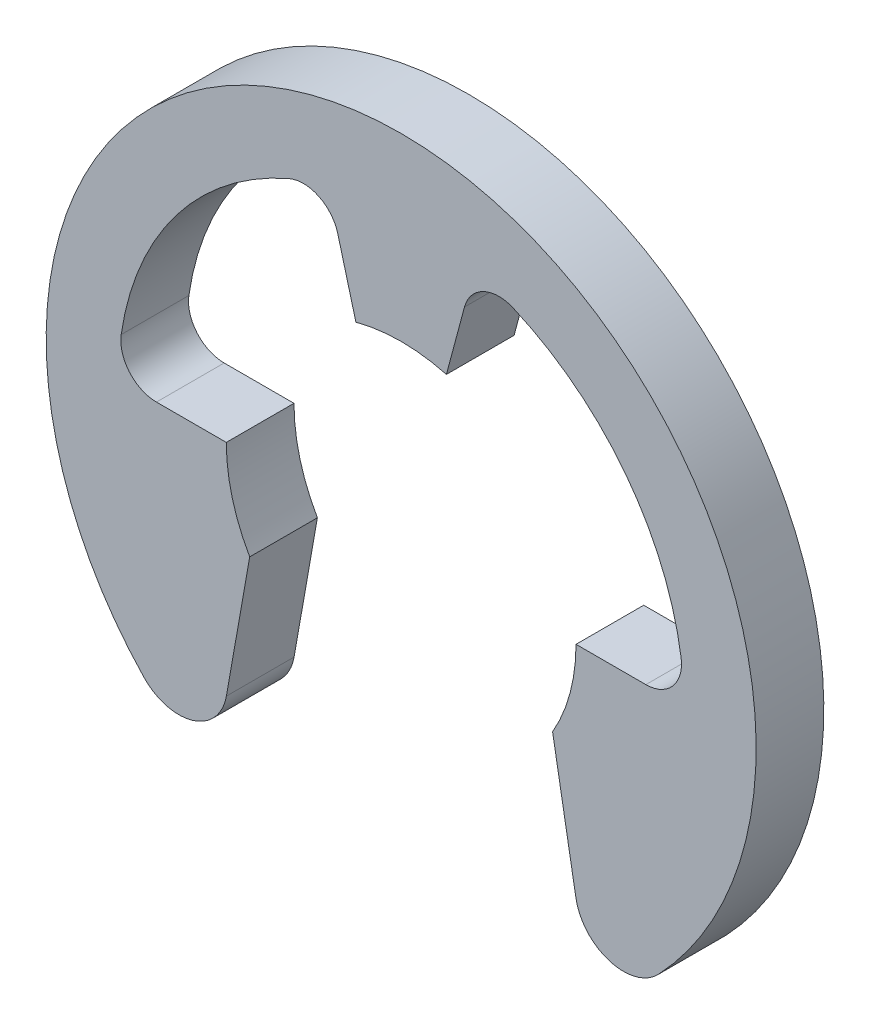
SolidWorks part; units mm, degrees
ref_plane "Plane1" through (0, 0, 0) normal (0, 0, 1) x (1, 0, 0)
ref_plane "Plane2" through (0, 0, 0) normal (0, 1, 0) x (1, 0, 0)
ref_plane "Plane3" through (0, 0, 0) normal (1, 0, 0) x (0, 0, -1)
extrude "Body" add sketch "BodySke" against normal blind 0.6
sketch "BodySke" plane through (0, 0, 0) normal (0, 0, 1) x (1, 0, 0)
  line L0 (-0.7581, 0) -> (0.7581, 0) construction
  line L1 (0, 0) -> (0, 1.55) construction
  line L2 (0, 0) -> (0.1962, 0.7323) construction
  line L3 (0, 0) -> (1.3423, -0.775) construction
  line L4 (0, 0) -> (-0.1962, 0.7323) construction
  line L5 (0, 0) -> (-1.3423, -0.775) construction
  line L6 (1.3423, -0.775) -> (1.5491, -1.9474)
  line L7 (-1.3423, -0.775) -> (-1.5491, -1.9474)
  line L9 (1.55, 0) -> (2.1689, 0)
  line L10 (-1.55, 0) -> (-2.1689, 0)
  line L11 (0.4012, 1.4972) -> (0.5613, 2.095)
  line L12 (-0.4012, 1.4972) -> (-0.5613, 2.095)
  circle A0 centre (0, 0) radius 1.55 construction
  arc A1 (2.4817, 0.3617) -> (0.9917, 2.3035) centre (0, 0) ccw
  arc A2 (2.2805, -2.1679) -> (-2.2805, -2.1679) centre (0, 0) ccw
  arc A3 (1.3423, -0.775) -> (1.55, 0) centre (0, 0) ccw
  arc A4 (-0.9917, 2.3035) -> (-2.4817, 0.3617) centre (0, 0) ccw
  arc A5 (-1.55, 0) -> (-1.3423, -0.775) centre (0, 0) ccw
  arc A6 (-0.4012, 1.4972) -> (0.4012, 1.4972) centre (0, 0) cw
  arc A7 (0.9917, 2.3035) -> (0.5613, 2.095) centre (0.8667, 2.0132) ccw
  arc A8 (1.5491, -1.9474) -> (2.2805, -2.1679) centre (1.9704, -1.8731) ccw
  arc A9 (-2.2805, -2.1679) -> (-1.5491, -1.9474) centre (-1.9704, -1.8731) ccw
  arc A10 (-2.4817, 0.3617) -> (-2.1689, 0) centre (-2.1689, 0.3161) ccw
  arc A11 (-0.5613, 2.095) -> (-0.9917, 2.3035) centre (-0.8667, 2.0132) ccw
  arc A12 (2.1689, 0) -> (2.4817, 0.3617) centre (2.1689, 0.3161) ccw
  dimension "D1" = 30
  dimension "GrooveDia" = 3.1
  dimension "OutsideDia" = 6.293
  dimension "D3" = 30
  dimension "TipRad" = 0.4279
  dimension "CavityDia" = 5.0158
  dimension "CavityFilletRad" = 0.3161
  dimension "D4" = 20
sketch "Clipboard" plane through (0, 0, 0) normal (0, 0, 1) x (1, 0, 0)
  line L0 (0, 0) -> (0.6386, 0)
  circle A0 centre (0, 0) radius 1.27
  circle A1 centre (0, 0) radius 2.5781
  dimension "FreeID" = 2.54
  dimension "FreeOD" = 5.1562
  dimension "Bridge" = 0.6386
sketch "Esquisse1" plane through (0, 0, 0) normal (1, 0, 0) x (0, 0, -1)
  line L1 (-1.0463, 3.4988) -> (1.3362, 3.4988)
  line L2 (-1.0463, 3.4988) -> (-1.0463, -2.637)
  line L3 (-1.0463, -2.637) -> (1.3362, -2.637)
  line L4 (1.3362, 3.4988) -> (1.3362, -2.637)
extrude "Coupe radiale" [suppressed] cut sketch "Esquisse1" along normal through all
equation "' \"FreeID@Clipboard\" = 0.025"
equation "' \"Thickness@Body\" = 0.01"
equation "' \"GrooveDia@BodySke\" = 0.026"
equation "' \"FreeOD@Clipboard\" = 0.079"
equation "' \"FreeID@Clipboard\" = 1.213"
equation "' \"Thickness@Body\" = 0.062"
equation "' \"GrooveDia@BodySke\" = 1.23"
equation "' \"FreeOD@Clipboard\" = 1.875"
equation "\"OutsideDia@BodySke\" = ( \"GrooveDia@BodySke\"  /  \"FreeID@Clipboard\" )  * \"FreeOD@Clipboard\""
equation "\"Bridge@Clipboard\" =  (\"OutsideDia@BodySke\" - \"GrooveDia@BodySke\") / 2 * 0.4"
equation "\"CavityDia@BodySke\" = \"OutsideDia@BodySke\"  - 2 * \"Bridge@Clipboard\""
equation "\"CavityFilletRad@BodySke\" =  (\"CavityDia@BodySke\" - \"GrooveDia@BodySke\") / 2 * 0.33"
equation "\"TipRad@BodySke\" = 0.67 * \"Bridge@Clipboard\""
